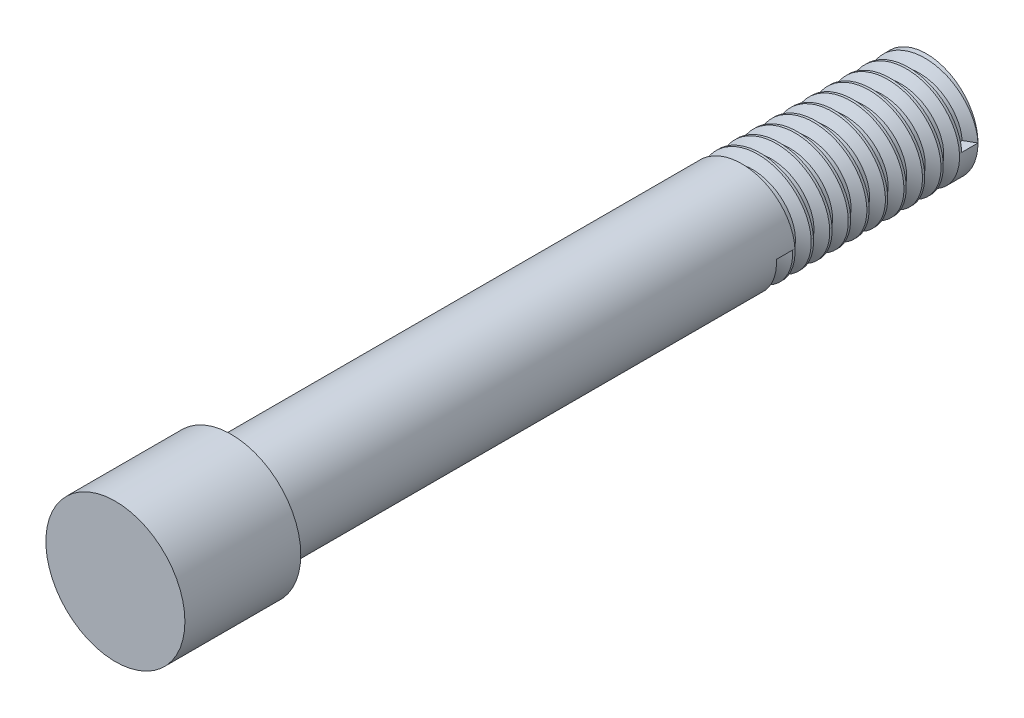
SolidWorks part; units mm, degrees
ref_plane "Ebene vorne" through (0, 0, 0) normal (0, 0, 1) x (1, 0, 0)
ref_plane "Ebene oben" through (0, 0, 0) normal (0, 1, 0) x (1, 0, 0)
ref_plane "Ebene rechts" through (0, 0, 0) normal (1, 0, 0) x (0, 0, -1)
sketch "Skizze1" plane through (0, 0, 0) normal (0, 0, 1) x (1, 0, 0)
  circle A0 centre (0, 0) radius 2.225
  dimension "D1" = 4.45
extrude "Aufsatz-Linear austragen1" add sketch "Skizze1" along normal blind 35
sketch "Skizze2" plane through (0, 0, 35) normal (0, 0, 1) x (1, 0, 0)
  circle A0 centre (0, 0) radius 3
  dimension "D1" = 6
extrude "Aufsatz-Linear austragen2" add sketch "Skizze2" against normal blind 5
fillet "Verrundung1" radius 0.5 1 edges at (2.225, 0, 30)
thread "Gewinde1" pitch 0.8 start angle 0, offset 0, length 8, pitch 0.8, diameter 4.45
ref_plane "Ebene1" through (2.225, 0, 0) normal (0, -1, 0) x (1, 0, 0)
sketch "Gewindeprofil1" plane through (2.225, 0, 0) normal (0, -1, 0) x (1, 0, 0)
  line L0 (0, 0) -> (0, 0.8) construction
  line L11 (0, 0) -> (0, 0.7)
  line L12 (0, 0.7) -> (-0.433, 0.45)
  line L13 (-0.433, 0.45) -> (-0.433, 0.25)
  line L15 (-0.433, 0.25) -> (0, 0)
  line L17 (-0.433, 0.35) -> (0, 0.35) construction
  point P2 (0, 0)
  dimension "Pitch" = 0.8
  dimension "Profile_Angle" = 60
  dimension "Profile_Land" = 0.2
  dimension "Profile_Height" = 0.433
